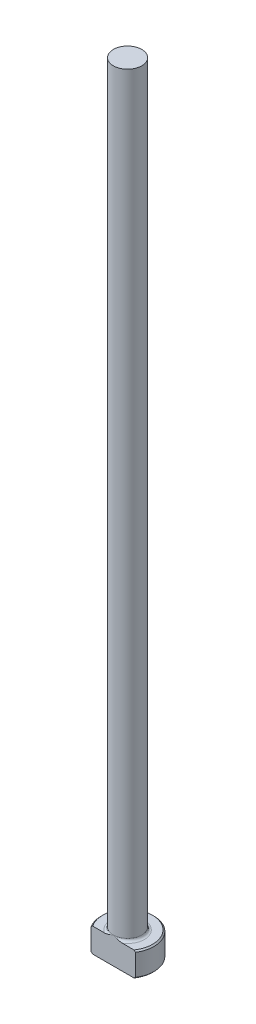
SolidWorks part; units mm, degrees
ref_plane "Front Plane" through (0, 0, 0) normal (0, 0, 1) x (1, 0, 0)
ref_plane "Top Plane" through (0, 0, 0) normal (0, 1, 0) x (1, 0, 0)
ref_plane "Right Plane" through (0, 0, 0) normal (1, 0, 0) x (0, 0, -1)
sketch "Sketch1" plane through (0, 0, 0) normal (0, 0, 1) x (1, 0, 0)
  line L0 (0, 259.9588) -> (0, -15.1925) construction
  line L1 (0, 0) -> (-5.1562, 0)
  line L2 (-5.1562, 0) -> (-5.1562, 4.7498)
  line L3 (-5.1562, 4.7498) -> (-2.7775, 4.7498)
  line L4 (-2.7775, 4.7498) -> (-2.7775, 152.4)
  line L5 (-2.7775, 152.4) -> (0, 152.4)
  line L6 (0, 152.4) -> (0, 0)
  dimension "L" = 152.4
  dimension "H" = 10.3124
  dimension "T" = 4.7498
  dimension "D" = 5.555
revolve "Revolve1" add sketch "Sketch1" angle 360 about L0
chamfer "Chamfer1" distance 0.254 angle 45 2 edges at (0, 4.7498, 5.1562) (0, 0, 5.1562)
fillet "Fillet1" radius 0.508 1 edges at (0, 4.7498, 2.7775)
sketch "Sketch2" plane through (0, 0, 0) normal (0, -1, 0) x (1, 0, 0)
  line L0 (-4.3442, 2.7775) -> (4.3442, 2.7775)
  arc A0 (4.3442, 2.7775) -> (-4.3442, 2.7775) centre (0, 0) ccw
  circle A1 centre (0, 0) radius 5.1562 construction
  circle A3 centre (0, 0) radius 2.7775 construction
extrude "KEY" cut sketch "Sketch2" against normal through all
sketch "Pocket Sketch" plane through (0, 0, 0) normal (0, 0, 1) x (1, 0, 0)
  line L0 (-5.5531, 0) -> (-5.5531, 4.7752)
  line L1 (-5.5531, 4.7752) -> (-3.7379, 4.7752)
  line L2 (-2.9759, 5.5372) -> (-2.9759, 22.225)
  line L3 (-2.9759, 22.225) -> (0, 22.225)
  line L4 (0, 22.225) -> (0, 0)
  line L5 (0, 0) -> (-5.5531, 0)
  line L6 (0, 12.6104) -> (0, -2.4989) construction
  line L7 (-5.1562, 4.4958) -> (-5.1562, 0.254) construction
  line L8 (4.9022, 4.7498) -> (-4.9022, 4.7498) construction
  line L9 (-2.7775, 152.4) -> (-2.7775, 5.2578) construction
  line L10 (-3.7379, 4.7752) -> (-2.9759, 5.5372)
  point P3 (-2.9759, 4.7752)
  dimension "D1" = 11.1061
  dimension "D2" = 0.3969
  dimension "D3" = 0.0254
  dimension "D4" = 0.1984
  dimension "D5" = 5.9519
  dimension "D6" = 22.225
